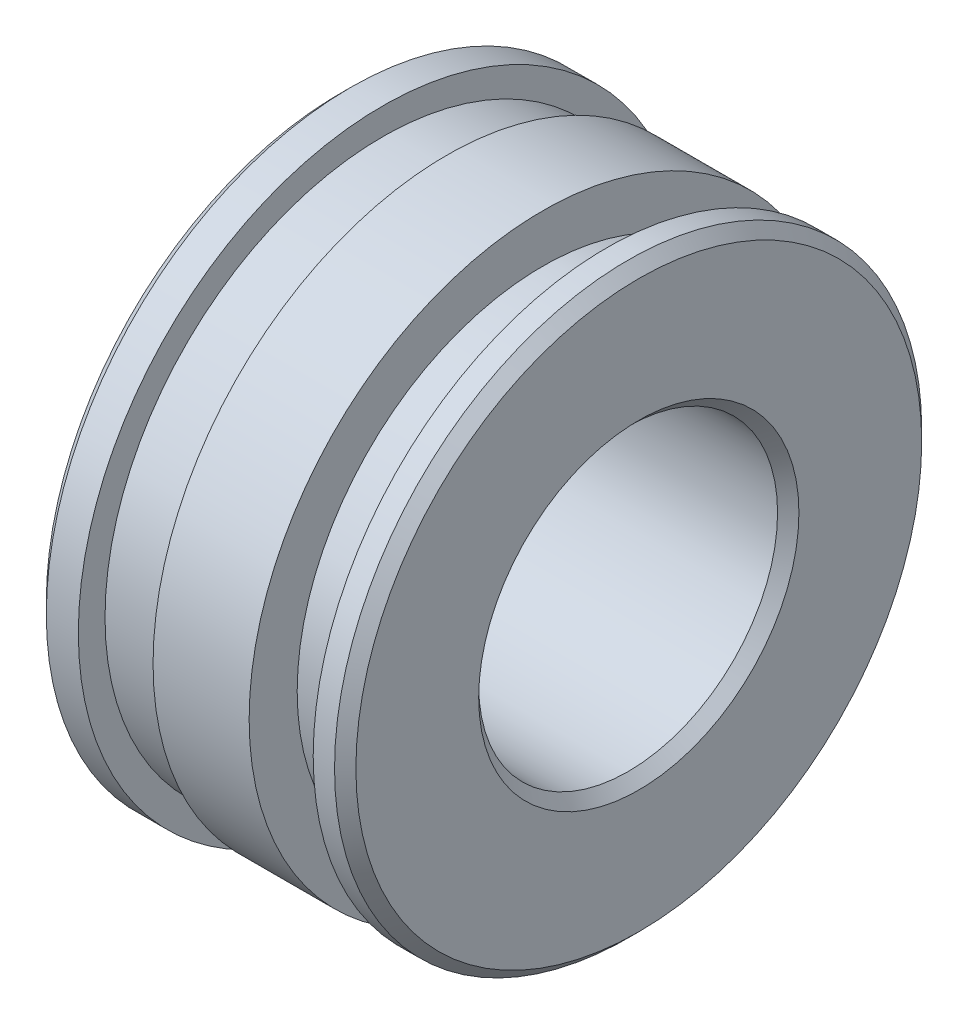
SolidWorks part; units mm, degrees
ref_plane "Plan de face" through (0, 0, 0) normal (0, 0, 1) x (1, 0, 0)
ref_plane "Plan de dessus" through (0, 0, 0) normal (0, 1, 0) x (1, 0, 0)
ref_plane "Plan de droite" through (0, 0, 0) normal (1, 0, 0) x (0, 0, -1)
sketch "Esquisse1" plane through (0, 0, 0) normal (0, 0, 1) x (1, 0, 0)
  line L1 (28, 14) -> (28, 27.5)
  line L2 (28, 27.5) -> (25, 27.5)
  line L3 (25, 27.5) -> (25, 23)
  line L4 (25, 23) -> (19, 23)
  line L5 (19, 23) -> (19, 27.5)
  line L6 (19, 27.5) -> (10, 27.5)
  line L7 (10, 27.5) -> (10, 26)
  line L8 (10, 26) -> (4, 26)
  line L9 (4, 26) -> (4, 28.5)
  line L10 (4, 28.5) -> (0, 28.5)
  line L11 (0, 28.5) -> (0, 14)
  line L12 (0, 14) -> (28, 14)
  line L13 (-19.248, 0) -> (42.9424, 0) construction
  dimension "D1" = 28.5
  dimension "D2" = 14
  dimension "D3" = 4
  dimension "D4" = 6
  dimension "D5" = 3
  dimension "D6" = 6
  dimension "D7" = 9
  dimension "D8" = 26
  dimension "D9" = 23
  dimension "D10" = 1.5
revolve "Révolution1" add sketch "Esquisse1" angle 360 about L13
chamfer "Chanfrein1" distance 1 angle 45 4 edges at (28, 0, 27.5) (0, 0, 28.5) (0, 0, 14) (28, 0, 14)
